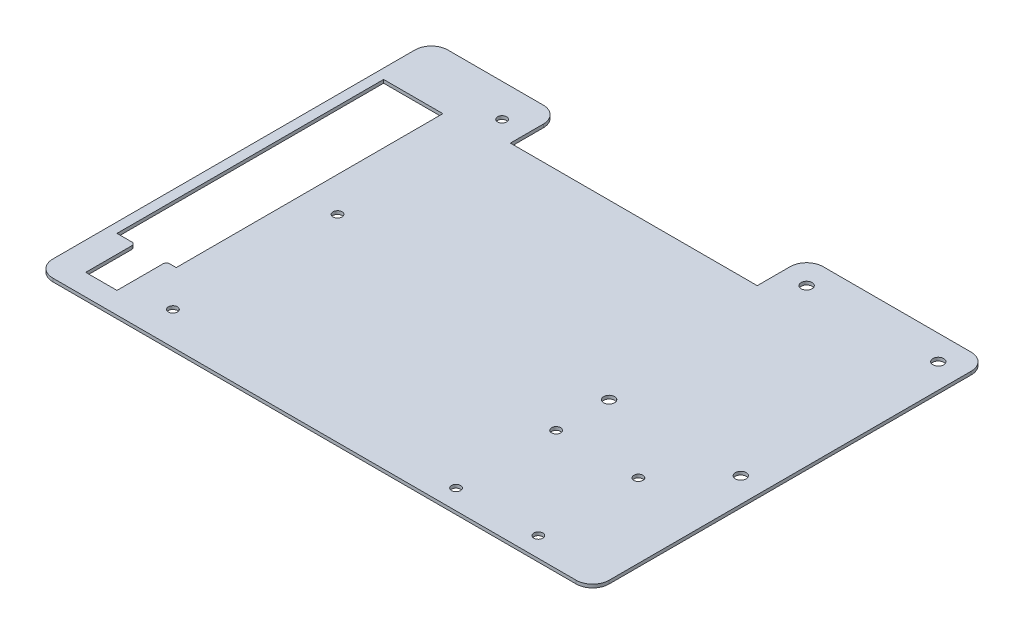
SolidWorks part; units mm, degrees
ref_plane "Front Plane" through (0, 0, 0) normal (0, 0, 1) x (1, 0, 0)
ref_plane "Top Plane" through (0, 0, 0) normal (0, 1, 0) x (1, 0, 0)
ref_plane "Right Plane" through (0, 0, 0) normal (1, 0, 0) x (0, 0, -1)
sketch "Sketch1" plane through (0, 0, 0) normal (0, 1, 0) x (1, 0, 0)
  line L1 (-150, -120) -> (150, -120)
  line L2 (-160, -110) -> (-160, 110)
  line L3 (-150, 120) -> (150, 120)
  line L4 (160, -110) -> (160, 110)
  line L5 (-160, -120) -> (160, 120) construction
  line L6 (-160, 120) -> (160, -120) construction
  arc A0 (-150, -120) -> (-160, -110) centre (-150, -110) cw
  arc A1 (150, -120) -> (160, -110) centre (150, -110) ccw
  arc A2 (150, 120) -> (160, 110) centre (150, 110) cw
  arc A3 (-160, 110) -> (-150, 120) centre (-150, 110) cw
  point P0 (0, 0)
  dimension "D3" = 10
  dimension "D1" = 320
  dimension "D2" = 240
extrude "Boss-Extrude1" add sketch "Sketch1" along normal blind 2
sketch "Sketch2" plane through (0, 2, 0) normal (0, 1, 0) x (1, 0, 0)
  line L0 (0, 120) -> (0, -120) construction
  line L1 (150, 120) -> (-150, 120) construction
  line L2 (-150, -120) -> (150, -120) construction
  circle A0 centre (-115, -100) radius 2.75
  circle A1 centre (-115, 100) radius 2.75
  circle A2 centre (-115, 0) radius 2.75
  dimension "D1" = 5.5
  dimension "D4" = 5.5
  dimension "D7" = 5.5
  dimension "D2" = 115
  dimension "D3" = 20
  dimension "D5" = 115
  dimension "D6" = 20
extrude "Cut-Extrude1" cut sketch "Sketch2" against normal through all
sketch "Sketch3" plane through (0, 2, 0) normal (0, 1, 0) x (1, 0, 0)
  line L0 (0, -120) -> (0, 120) construction
  line L1 (150, 120) -> (-150, 120) construction
  line L2 (-150, -120) -> (150, -120) construction
  line L3 (160, -110) -> (160, 110) construction
  line L4 (150, 120) -> (-150, 120) construction
  line L5 (-150, -120) -> (150, -120) construction
  circle A141 centre (145, 105) radius 3.3
  circle A142 centre (145, -15) radius 3.3
  circle A143 centre (65, -15) radius 3.3
  circle A144 centre (65, 105) radius 3.3
  circle A145 centre (115, -108) radius 2.75
  circle A146 centre (65, -108) radius 2.75
  circle A147 centre (65, -47.2) radius 2.75
  circle A148 centre (115, -47.2) radius 2.75
  dimension "D1" = 6.6
  dimension "D4" = 6.6
  dimension "D7" = 6.6
  dimension "D9" = 6.6
  dimension "D12" = 5.5
  dimension "D16" = 5.5
  dimension "D21" = 5.5
  dimension "D22" = 5.5
  dimension "D2" = 15
  dimension "D3" = 15
  dimension "D6" = 15
  dimension "D5" = 120
  dimension "D8" = 80
  dimension "D10" = 80
  dimension "D11" = 120
  dimension "D13" = 45
  dimension "D14" = 12
  dimension "D15" = 50
  dimension "D17" = 12
  dimension "D18" = 60.8
  dimension "D19" = 60.8
  dimension "D20" = 50
extrude "Cut-Extrude2" cut sketch "Sketch3" against normal through all
sketch "Sketch4" plane through (0, 2, 0) normal (0, 1, 0) x (1, 0, 0)
  line L0 (150, 120) -> (-150, 120) construction
  line L1 (-100, 120) -> (50, 120)
  line L2 (-100, 120) -> (-100, 90)
  line L3 (-100, 90) -> (50, 90)
  line L4 (50, 120) -> (50, 90)
  circle A0 centre (-115, 100) radius 2.75 construction
  circle A1 centre (65, 105) radius 3.3 construction
  dimension "D1" = 30
  dimension "D2" = 15
  dimension "D3" = 15
extrude "Cut-Extrude3" cut sketch "Sketch4" against normal blind 10
fillet "Fillet1" radius 10 2 edges at (50, 1, -120) (-100, 1, -120)
sketch "Sketch6" plane through (0, 0, 0) normal (0, 1, 0) x (1, 0, 0)
  line L1 (-150, -120) -> (-178, -120)
  line L2 (-150, -120) -> (-150, 120)
  line L3 (-150, 120) -> (-178, 120)
  line L4 (-178, -120) -> (-178, 120)
  circle A0 centre (-115, -100) radius 2.75 construction
  dimension "D1" = 240
  dimension "D2" = 63
extrude "Boss-Extrude2" add sketch "Sketch6" along normal blind 2
sketch "Sketch7" plane through (0, 2, 0) normal (0, 1, 0) x (1, 0, 0)
  line L0 (-110, 120) -> (-178, 120) construction
  line L1 (-172, -77) -> (-163, -77)
  line L2 (-172, -77) -> (-172, 85)
  line L3 (-172, 85) -> (-136, 85)
  line L4 (-136, -77) -> (-136, 85)
  line L10 (-140, -77) -> (-136, -77)
  line L12 (-161, -79) -> (-161, -107)
  line L13 (-161, -107) -> (-142, -107)
  line L14 (-142, -79) -> (-142, -107)
  circle A0 centre (-115, -100) radius 2.75 construction
  arc A1 (-140, -77) -> (-142, -79) centre (-140, -79) ccw
  arc A2 (-163, -77) -> (-161, -79) centre (-163, -79) cw
  point P16 (-161, -77)
  dimension "D8" = 2
  dimension "D1" = 162
  dimension "D2" = 21
  dimension "D3" = 36
  dimension "D4" = 35
  dimension "D5" = 30
  dimension "D6" = 6
  dimension "D7" = 11
extrude "Cut-Extrude5" cut sketch "Sketch7" against normal through all
fillet "Fillet2" radius 10 2 edges at (-178, 1, -120) (-178, 1, 120)
